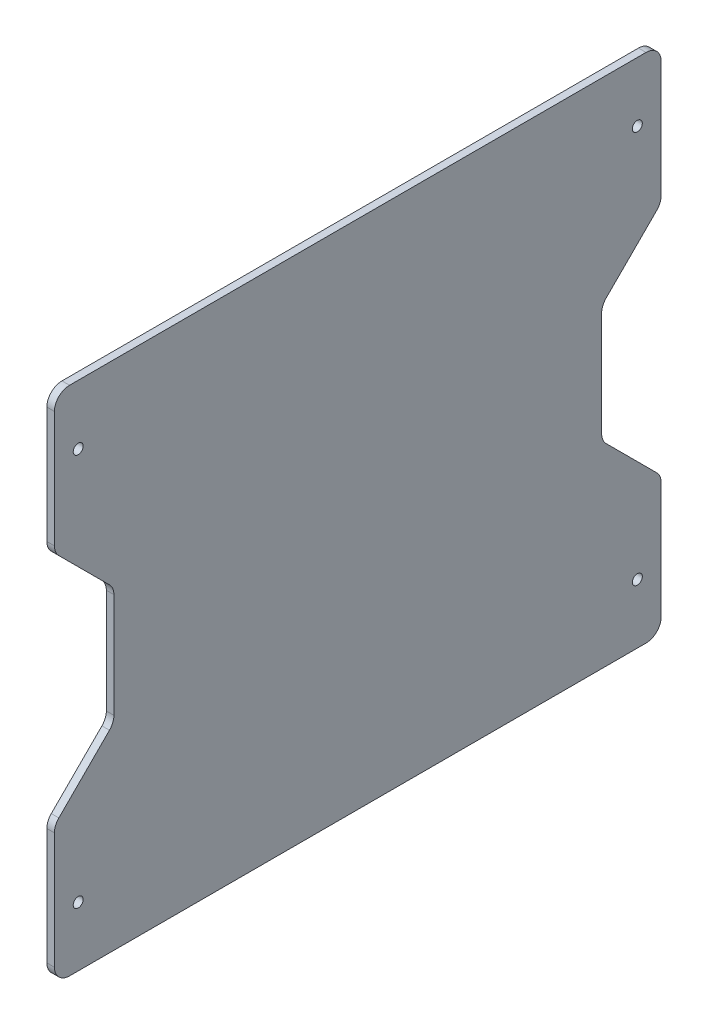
SolidWorks part; units mm, degrees
ref_plane "Front Plane" through (0, 0, 0) normal (0, 0, 1) x (1, 0, 0)
ref_plane "Top Plane" through (0, 0, 0) normal (0, 1, 0) x (1, 0, 0)
ref_plane "Right Plane" through (0, 0, 0) normal (1, 0, 0) x (0, 0, -1)
sketch "Sketch1" plane through (0, 0, 0) normal (0, 0, 1) x (1, 0, 0)
  line L2 (-2178.0251, -215) -> (-2171.4051, -215) construction
  line L3 (-2178.0251, 0) -> (-2171.4051, 0) construction
  line L5 (-2178.5251, -215) -> (-2178.5251, 0) construction
  line L7 (-2191.2251, -215) -> (-2194.4001, -215)
  line L8 (-2191.2251, -215) -> (-2191.2251, 0)
  line L9 (-2191.2251, 0) -> (-2194.4001, 0)
  line L10 (-2194.4001, -215) -> (-2194.4001, 0)
  dimension "D1" = 3.175
  dimension "D2" = 12.7
extrude "Boss-Extrude1" add sketch "Sketch1" against normal up to surface (255 mm away)
sketch "Sketch2" plane through (-2194.4001, 0, 0) normal (-1, 0, 0) x (0, 0, 1)
  line L0 (-245, -190) -> (-245, -25) construction
  line L1 (-255, 0) -> (-255, -215) construction
  line L2 (-235, -57.5) -> (-255, -57.5)
  line L3 (-235, -57.5) -> (-235, -157.5)
  line L4 (-235, -157.5) -> (-255, -157.5)
  line L5 (-255, -57.5) -> (-255, -157.5)
  line L6 (-235, -57.5) -> (-255, -157.5) construction
  line L7 (-235, -157.5) -> (-255, -57.5) construction
  line L9 (-235, -157.5) -> (-230, -157.5)
  line L10 (-235, -157.5) -> (-235, -57.5)
  line L11 (-235, -57.5) -> (-230, -57.5)
  line L12 (-230, -157.5) -> (-230, -57.5)
  line L14 (-255, 0) -> (0, 0) construction
  circle A0 centre (-245, -190) radius 2.095 construction
  circle A1 centre (-245, -25) radius 2.095 construction
  circle A2 centre (-10, -190) radius 2.095 construction
  circle A3 centre (-10, -25) radius 2.095 construction
  circle A4 centre (-245, -190) radius 2.095
  circle A5 centre (-245, -25) radius 2.095
  circle A6 centre (-10, -190) radius 2.095
  circle A7 centre (-10, -25) radius 2.095
  point P12 (-245, -107.5)
  dimension "D1" = 100
  dimension "D2" = 5
extrude "Cut-Extrude1" cut sketch "Sketch2" against normal up to next contours L4 L3 L2 M11 | L9 L12 L11 L3 | A4 | A5
ref_plane "Plane1" through (0, 0, -127.5) normal (0, 0, -1) x (-1, 0, 0)
chamfer "Chamfer1" distance 25.4 angle 45 2 edges at (-2192.8126, -57.5, -230) (-2192.8126, -157.5, -230)
mirror "Mirror1" about plane through (0, 0, -127.5) normal (0, 0, -1) of "Chamfer1", "Cut-Extrude1"
fillet "Fillet1" radius 6.35 12 edges at (-2192.8126, -132.1, -230) (-2192.8126, -157.1, -255) (-2192.8126, -82.9, -230) (-2192.8126, -57.9, -255) (-2192.8126, -157.1, 0) (-2192.8126, -132.1, -25) (-2192.8126, -82.9, -25) (-2192.8126, -57.9, 0) (-2192.8126, 0, 0) (-2192.8126, 0, -255) (-2192.8126, -215, -255) (-2192.8126, -215, 0)
